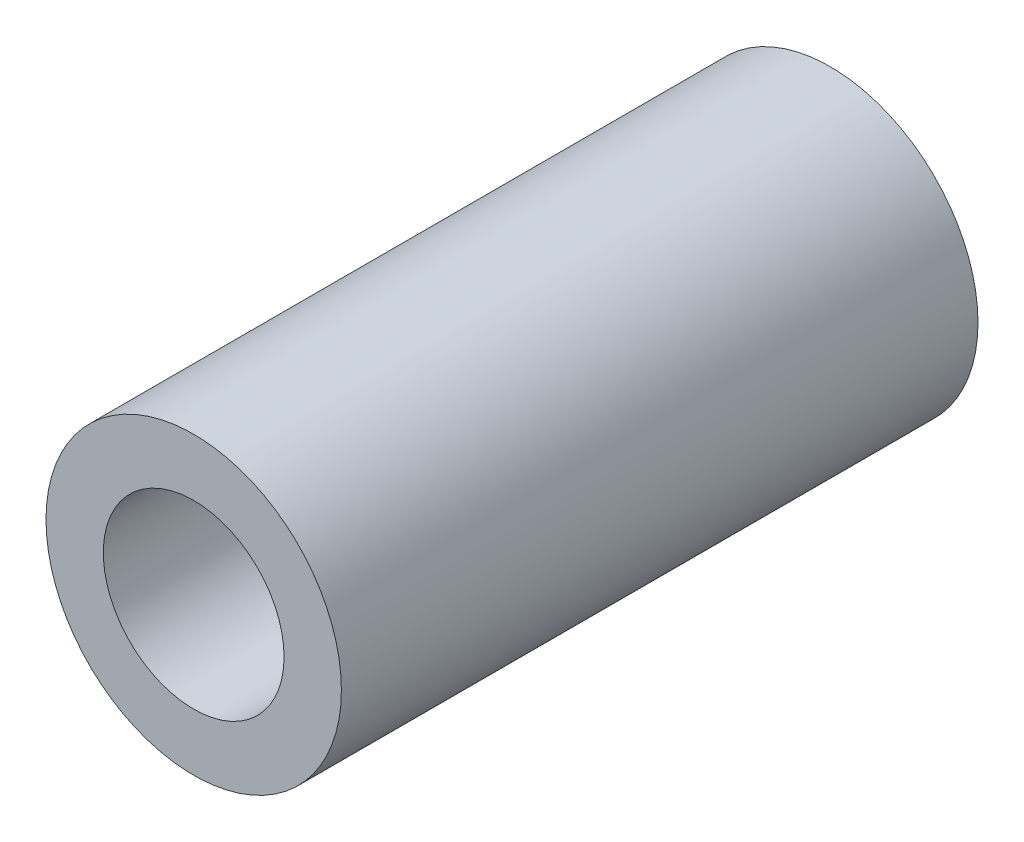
SolidWorks part; units mm, degrees
ref_plane "Plan de face" through (0, 0, 0) normal (0, 0, 1) x (1, 0, 0)
ref_plane "Plan de dessus" through (0, 0, 0) normal (0, 1, 0) x (1, 0, 0)
ref_plane "Plan de droite" through (0, 0, 0) normal (1, 0, 0) x (0, 0, -1)
sketch "Esquisse1" plane through (0, 0, 0) normal (0, 0, 1) x (1, 0, 0)
  circle A0 centre (0, 0) radius 4.6
  circle A1 centre (0, 0) radius 11.6
  dimension "D1" = 9.2
  dimension "D2" = 7
extrude "Extrusion1" add sketch "Esquisse1" along normal blind 50
sketch "Esquisse2" plane through (0, 0, 50) normal (0, 0, 1) x (1, 0, 0)
  circle A0 centre (0, 0) radius 7.1
  dimension "D1" = 14.2
extrude "Extrusion2" cut sketch "Esquisse2" against normal blind 20
